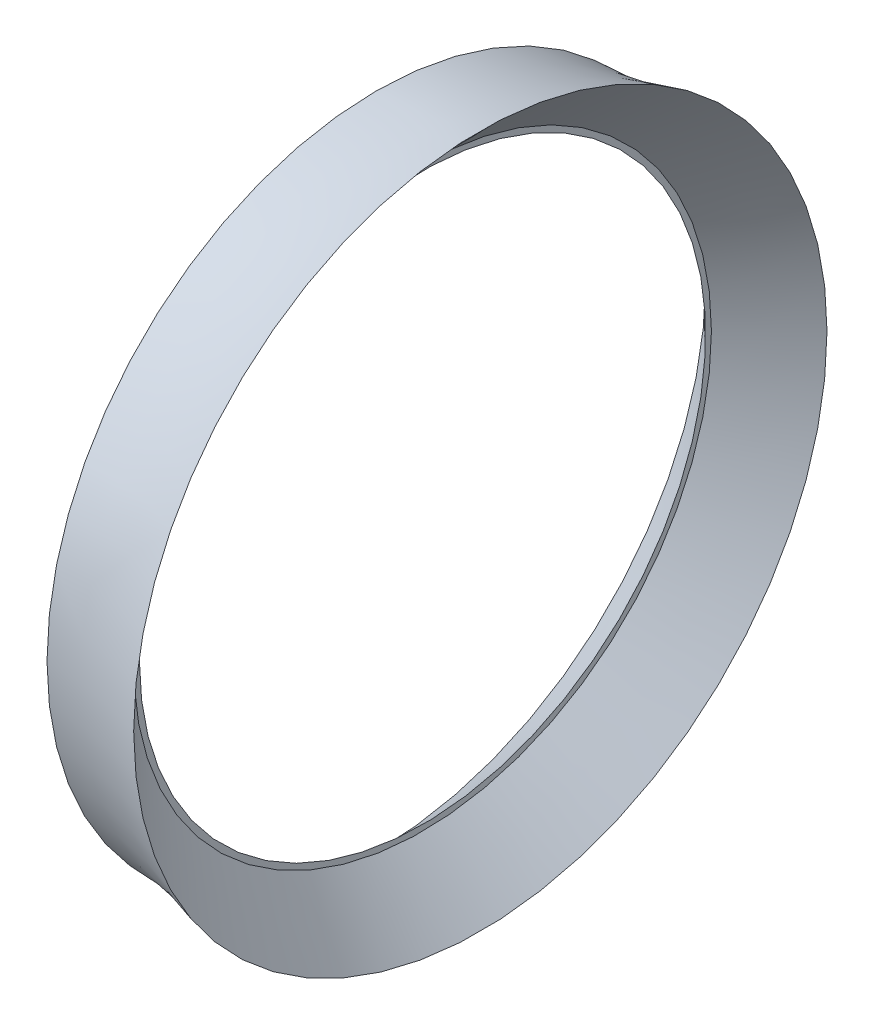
SolidWorks part; units mm, degrees
ref_plane "Plan de face" through (0, 0, 0) normal (0, 0, 1) x (1, 0, 0)
ref_plane "Plan de dessus" through (0, 0, 0) normal (0, 1, 0) x (1, 0, 0)
ref_plane "Plan de droite" through (0, 0, 0) normal (1, 0, 0) x (0, 0, -1)
sketch "Esquisse1" plane through (0, 0, 0) normal (0, 0, 1) x (1, 0, 0)
  line L0 (-55, 85.505) -> (-90.9621, 85.505) construction
  line L1 (-77.5, 100.505) -> (-80, 98.005) construction
  line L2 (-77.5, 100.505) -> (-80, 98.005)
  line L3 (-80, 97.755) -> (-82, 99.755) construction
  line L4 (-80, 97.755) -> (-82, 99.755)
  line L6 (-80, 98.005) -> (-80, 73.005) construction
  line L7 (-82, 99.755) -> (-87, 99.755) construction
  line L8 (-80, 98.005) -> (-80, 97.755)
  arc A0 (-77.5, 100.505) -> (-82, 99.755) centre (-82, 113.63) cw
revolve "Révolution1" add sketch "Esquisse1" angle 360 about L0
